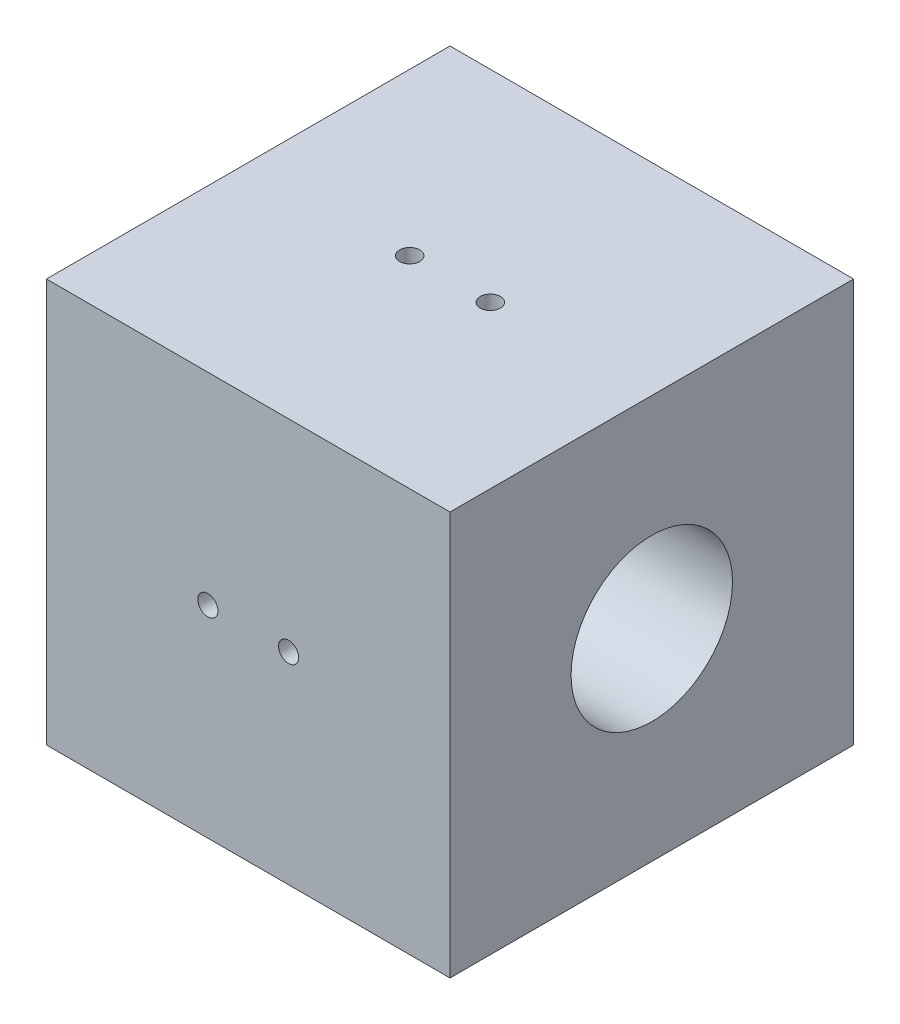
SolidWorks part; units mm, degrees
ref_plane "Front Plane" through (0, 0, 0) normal (0, 0, 1) x (1, 0, 0)
ref_plane "Top Plane" through (0, 0, 0) normal (0, 1, 0) x (1, 0, 0)
ref_plane "Right Plane" through (0, 0, 0) normal (1, 0, 0) x (0, 0, -1)
sketch "Sketch the 5*5 in square" plane through (0, 0, 0) normal (0, 0, 1) x (1, 0, 0)
  line L5 (-63.5, -63.5) -> (63.5, -63.5)
  line L6 (-63.5, -63.5) -> (-63.5, 63.5)
  line L11 (-63.5, 63.5) -> (63.5, 63.5)
  line L12 (63.5, -63.5) -> (63.5, 63.5)
  line L17 (-63.5, -63.5) -> (63.5, 63.5) construction
  line L18 (-63.5, 63.5) -> (63.5, -63.5) construction
  point P0 (0, 0)
  dimension "D1" = 127
  dimension "D2" = 127
extrude "Boss-extrude the square to make cube box" add sketch "Sketch the 5*5 in square" along normal blind 127
sketch "Sketch circles on the side views" plane through (-63.5, 0, 0) normal (-1, 0, 0) x (0, 0, 1)
  line L0 (127, 63.5) -> (0, 63.5) construction
  line L1 (0, 63.5) -> (0, -63.5) construction
  circle A0 centre (63.5, 0) radius 25.4
  dimension "D1" = 50.8
  dimension "D2" = 63.5
  dimension "D3" = 63.5
sketch "Sketch two circles on the top side" plane through (0, 63.5, 0) normal (0, 1, 0) x (1, 0, 0)
  line L0 (-63.5, -127) -> (-63.5, 0) construction
  line L1 (63.5, -127) -> (63.5, 0) construction
  line L2 (63.5, 0) -> (-63.5, 0) construction
  circle A0 centre (-12.7, -63.5) radius 3.175
  circle A1 centre (12.7, -63.5) radius 3.175
  dimension "D1" = 6.35
  dimension "D2" = 6.35
  dimension "D3" = 50.8
  dimension "D4" = 50.8
  dimension "D5" = 63.5
  dimension "D6" = 63.5
extrude "Cut-Extrude small circles to make holes for ziptie" cut sketch "Sketch two circles on the top side" against normal mid plane 96
sketch "Sketch two circles to make holes for ziptie" plane through (0, 0, 127) normal (0, 0, 1) x (1, 0, 0)
  line L0 (63.5, 63.5) -> (-63.5, 63.5) construction
  line L1 (63.5, -63.5) -> (63.5, 63.5) construction
  line L2 (-63.5, -63.5) -> (63.5, -63.5) construction
  line L3 (-63.5, 25.4) -> (-63.5, -25.4) construction
  circle A0 centre (-12.7, 0) radius 3.175
  circle A1 centre (12.7, 0) radius 3.175
  dimension "D1" = 6.35
  dimension "D2" = 6.35
  dimension "D3" = 63.5
  dimension "D4" = 50.8
  dimension "D5" = 63.5
  dimension "D6" = 50.8
extrude "Cut-Extrude small circles only to the midway" cut sketch "Sketch two circles to make holes for ziptie" against normal mid plane 96
extrude "Cut-Extrude circle on the side viewa" cut sketch "Sketch circles on the side views" against normal through all
